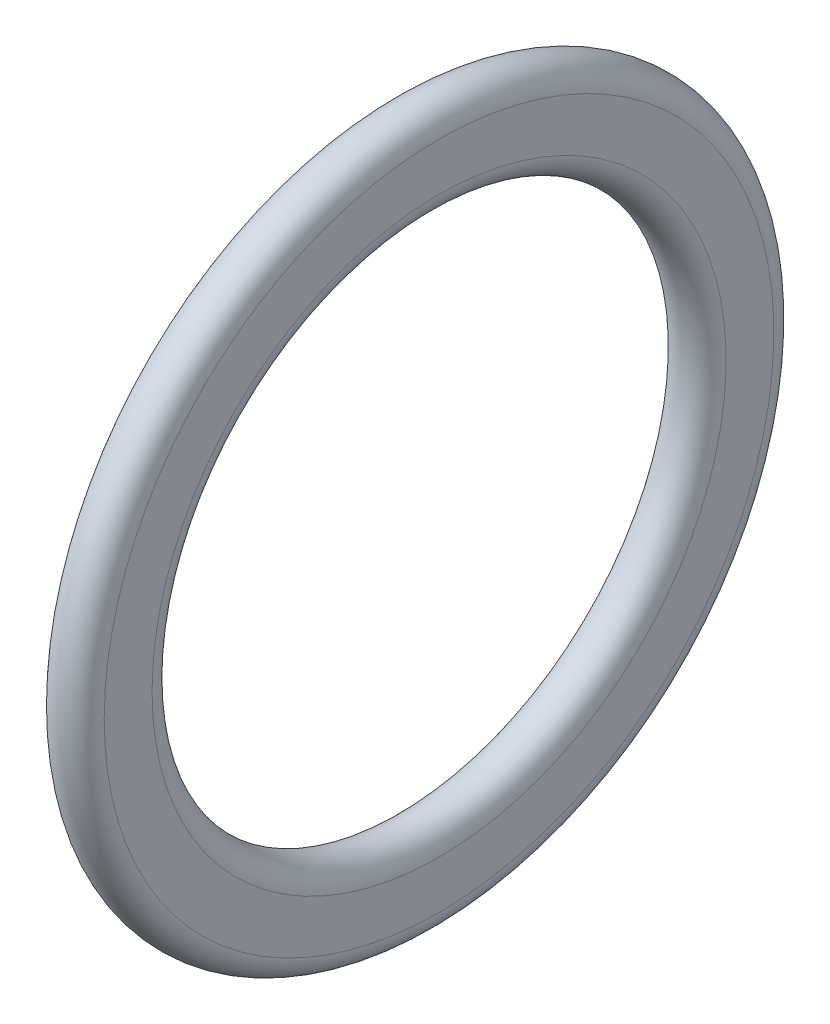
SolidWorks part; units mm, degrees
ref_plane "Plan de face" through (0, 0, 0) normal (0, 0, 1) x (1, 0, 0)
ref_plane "Plan de dessus" through (0, 0, 0) normal (0, 1, 0) x (1, 0, 0)
ref_plane "Plan de droite" through (0, 0, 0) normal (1, 0, 0) x (0, 0, -1)
sketch "Esquisse1" plane through (0, 0, 0) normal (0, 0, 1) x (1, 0, 0)
  line L0 (-8.8482, 6) -> (15.9267, 6) construction
  line L1 (0, -3.9444) -> (0, 17.329) construction
  line L2 (-0.5, 7) -> (-0.5, 6)
  line L3 (0.5, 7) -> (0.5, 6)
  line L4 (0, 0) -> (21.2766, 0) construction
  arc A0 (-0.5, 7) -> (0.5, 7) centre (0, 7) cw
  arc A1 (-0.5, 6) -> (0.5, 6) centre (0, 6) ccw
  dimension "D4" = 7
  dimension "D1" = 6
  dimension "D2" = 0.5
  dimension "D3" = 0.5
  dimension "D5" = 7
  dimension "D6" = 1
  dimension "D7" = 1
revolve "Révolution1" add sketch "Esquisse1" angle 360 about L4
